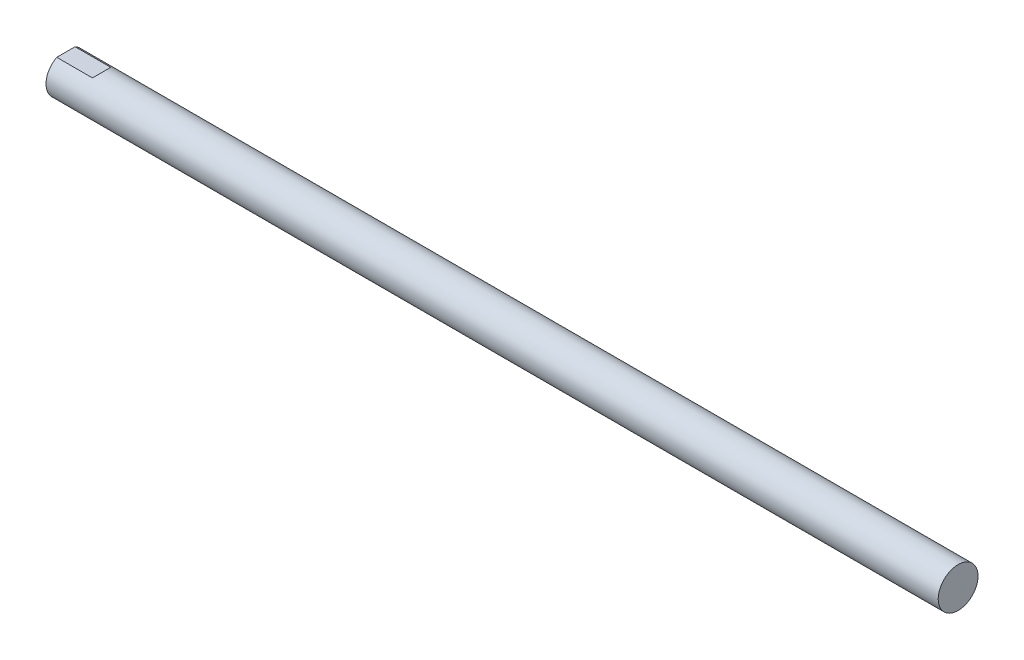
SolidWorks part; units mm, degrees
ref_plane "Front Plane" through (0, 0, 0) normal (0, 0, 1) x (1, 0, 0)
ref_plane "Top Plane" through (0, 0, 0) normal (0, 1, 0) x (1, 0, 0)
ref_plane "Right Plane" through (0, 0, 0) normal (1, 0, 0) x (0, 0, -1)
sketch "Sketch1" plane through (0, 0, 0) normal (0, 0, 1) x (1, 0, 0)
  line L0 (0, 0) -> (0, 7.9375)
  line L1 (0, 7.9375) -> (355.6, 7.9375)
  line L2 (355.6, 7.9375) -> (355.6, 0)
  line L3 (355.6, 0) -> (0, 0)
  line L4 (-29.8622, 0) -> (246.4486, 0) construction
  dimension "D1" = 15.875
  dimension "D2" = 355.6
revolve "Revolve1" add sketch "Sketch1" angle 360 about L4
hole_wizard "5/16-18 Tapped Hole1" positions "Sketch3" profile "Sketch2" tap size "5/16-18" standard "ANSI Inch"
sketch "Sketch3" plane through (0, 0, 0) normal (-1, 0, 0) x (0, 0, 1)
  point P0 (0, 0)
sketch "Sketch2" plane through (0, 0, 0) normal (0, 1, 0) x (0, 0, 1)
  line L0 (0, 0) -> (0, 24.8973)
  line L1 (0, 24.8973) -> (3.2639, 22.9362)
  line L2 (3.2639, 22.9362) -> (3.2639, 0)
  line L5 (3.2639, 0) -> (0, 0)
  line L10 (0, 24.8973) -> (-3.2639, 22.9362) construction
  line L11 (0, -6.35) -> (0, 107.95) construction
  dimension "Tap Drill Dia." = 6.5278
  dimension "Tap Drill Depth" = 22.9362
  dimension "Drill Angle" = 118
sketch "Sketch4" plane through (0, 0, 0) normal (0, 0, 1) x (1, 0, 0)
  line L0 (0, 7.0485) -> (14.224, 7.0485)
  line L1 (0, 7.9375) -> (0, -7.9375) construction
  line L2 (14.224, 7.0485) -> (15.113, 7.9375)
  line L3 (355.6, 7.9375) -> (0, 7.9375) construction
  line L4 (15.113, 7.9375) -> (0, 7.9375)
  line L5 (0, 7.9375) -> (0, 7.0485)
  line L6 (-5.7422, 0) -> (50.3718, 0) construction
  line L7 (0, -7.9375) -> (355.6, -7.9375) construction
  dimension "D1" = 14.986
  dimension "D2" = 45
  dimension "D3" = 14.224
extrude "Cut-Extrude1" cut sketch "Sketch4" against normal through all both and the other way through all
